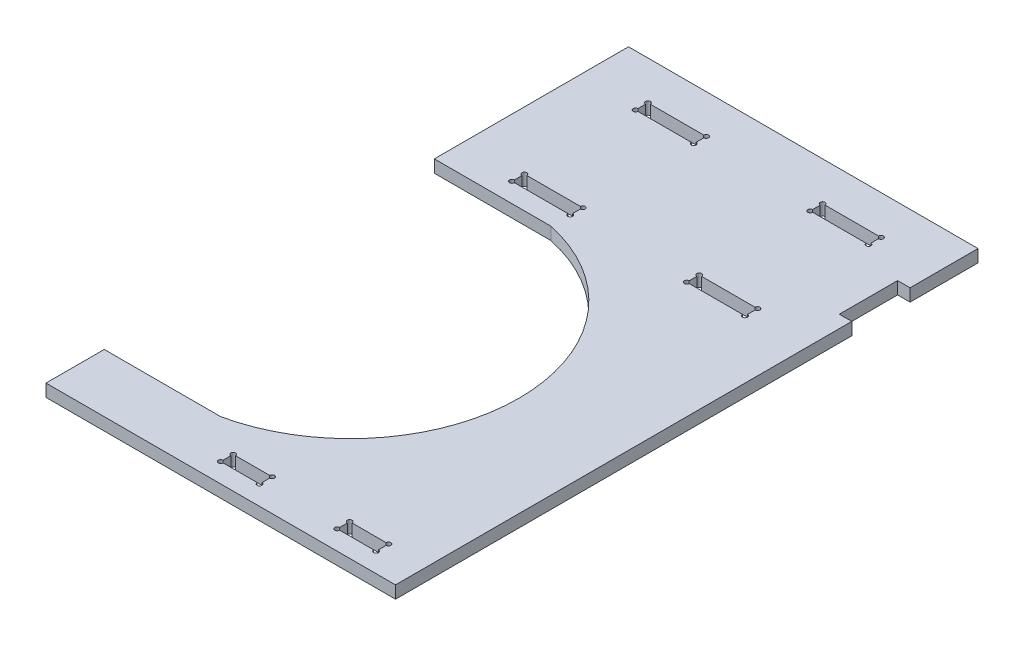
SolidWorks part; units mm, degrees
ref_plane "Front Plane" through (0, 0, 0) normal (0, 0, 1) x (1, 0, 0)
ref_plane "Top Plane" through (0, 0, 0) normal (0, 1, 0) x (1, 0, 0)
ref_plane "Right Plane" through (0, 0, 0) normal (1, 0, 0) x (0, 0, -1)
sketch "Sketch1" plane through (0, 0, 0) normal (0, 1, 0) x (1, 0, 0)
  line L0 (0, 0) -> (457.2, 0)
  line L1 (457.2, 762) -> (457.2, 673.1)
  line L2 (457.2, 762) -> (0, 762)
  line L3 (0, 762) -> (0, 508)
  line L4 (0, 508) -> (152.4, 508)
  line L5 (0, 0) -> (0, 76.2)
  line L6 (0, 76.2) -> (152.4, 76.2)
  line L7 (457.2, 596.9) -> (457.2, 0)
  line L8 (457.2, 673.1) -> (440.9, 673.1)
  line L9 (406.4, 25.4) -> (355.6, 25.4)
  line L10 (228.6, 762) -> (228.6, -17.505) construction
  line L11 (76.2, 711.2) -> (152.4, 711.2)
  line L12 (76.2, 711.2) -> (76.2, 694.9)
  line L13 (76.2, 694.9) -> (152.4, 694.9)
  line L14 (152.4, 711.2) -> (152.4, 694.9)
  line L15 (381, 711.2) -> (381, 694.9)
  line L16 (381, 694.9) -> (304.8, 694.9)
  line L17 (304.8, 711.2) -> (304.8, 694.9)
  line L18 (381, 711.2) -> (304.8, 711.2)
  line L19 (355.6, 25.4) -> (355.6, 41.7)
  line L20 (76.2, 533.4) -> (152.4, 533.4)
  line L21 (152.4, 533.4) -> (152.4, 549.7)
  line L22 (152.4, 549.7) -> (76.2, 549.7)
  line L23 (76.2, 549.7) -> (76.2, 533.4)
  line L24 (381, 549.7) -> (381, 533.4)
  line L25 (381, 533.4) -> (304.8, 533.4)
  line L26 (304.8, 533.4) -> (304.8, 549.7)
  line L27 (304.8, 549.7) -> (381, 549.7)
  line L28 (355.6, 41.7) -> (406.4, 41.7)
  line L29 (406.4, 41.7) -> (406.4, 25.4)
  line L30 (440.9, 673.1) -> (440.9, 596.9)
  line L31 (440.9, 596.9) -> (457.2, 596.9)
  line L32 (254, 25.4) -> (254, 41.7)
  line L33 (203.2, 25.4) -> (254, 25.4)
  line L34 (203.2, 41.7) -> (203.2, 25.4)
  line L35 (254, 41.7) -> (203.2, 41.7)
  arc A0 (152.4, 508) -> (152.4, 76.2) centre (105.6568, 292.1) cw
extrude "Boss-Extrude2" add sketch "Sketch1" along normal blind 16.3 contours L15 L16 L17 L18 | L11 L14 L13 L12 | L9 L19 L28 L29 | L0 L7 L31 L30 L8 L1 L2 L3 L4 A0 L6 L5 | L24 L25 L26 L27 | L20 L21 L22 L23 | L32 L35 L34 L33
sketch "Sketch2" plane through (0, 16.3, 0) normal (0, 1, 0) x (1, 0, 0)
  circle A0 centre (152.4, 549.7) radius 3.175
  circle A1 centre (76.2, 549.7) radius 3.175
  circle A2 centre (76.2, 533.4) radius 3.175
  circle A3 centre (152.4, 533.4) radius 3.175
  circle A4 centre (152.4, 711.2) radius 3.175
  circle A5 centre (76.2, 711.2) radius 3.175
  circle A6 centre (76.2, 694.9) radius 3.175
  circle A7 centre (152.4, 694.9) radius 3.175
  circle A8 centre (381, 711.2) radius 3.175
  circle A9 centre (381, 694.9) radius 3.175
  circle A10 centre (304.8, 694.9) radius 3.175
  circle A11 centre (304.8, 711.2) radius 3.175
  circle A12 centre (381, 533.4) radius 3.175
  circle A13 centre (381, 549.7) radius 3.175
  circle A14 centre (304.8, 549.7) radius 3.175
  circle A15 centre (304.8, 533.4) radius 3.175
  circle A16 centre (406.4, 25.4) radius 3.175
  circle A17 centre (406.4, 41.7) radius 3.175
  circle A18 centre (355.6, 41.7) radius 3.175
  circle A19 centre (355.6, 25.4) radius 3.175
  circle A20 centre (203.2, 41.7) radius 3.175
  circle A21 centre (254, 41.7) radius 3.175
  circle A22 centre (254, 25.4) radius 3.175
  circle A23 centre (203.2, 25.4) radius 3.175
extrude "Cut-Extrude1" cut sketch "Sketch2" against normal blind 16.3
